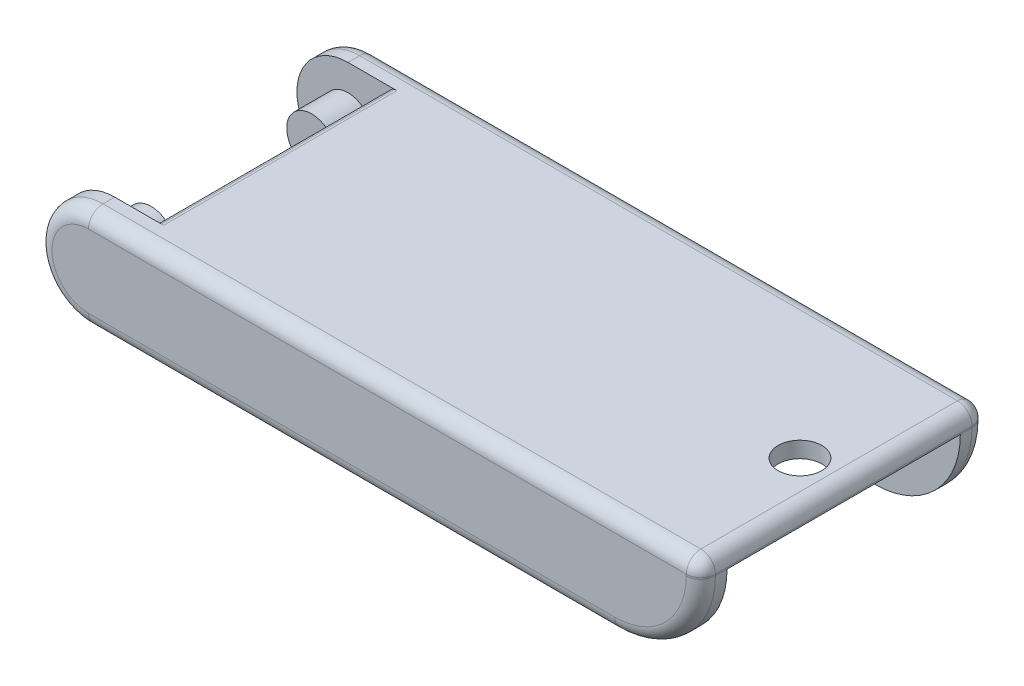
SolidWorks part; units mm, degrees
ref_plane "Plan de face" through (0, 0, 0) normal (0, 0, 1) x (1, 0, 0)
ref_plane "Plan de dessus" through (0, 0, 0) normal (0, 1, 0) x (1, 0, 0)
ref_plane "Plan de droite" through (0, 0, 0) normal (1, 0, 0) x (0, 0, -1)
sketch "Esquisse1" plane through (0, 0, 0) normal (0, 0, 1) x (1, 0, 0)
  line L0 (-26.893, 0) -> (0.9816, 0) construction
  line L1 (0, 23.3763) -> (0, -28.3411) construction
  line L2 (0, -3.5) -> (21.1985, -3.5) construction
  line L3 (0, 3.5) -> (21.7012, 3.5) construction
  line L4 (2.2491, 2) -> (23.4801, 2) construction
  line L5 (1.2823, -2.5) -> (22.2813, -2.5) construction
  line L6 (3.5, 0) -> (3.5, -9.601) construction
  line L7 (6.5, 1.3432) -> (6.5, -4.1096) construction
  line L8 (15, 1.3432) -> (15, -13.5069) construction
  line L9 (2.5971, 0.8) -> (18.066, 0.8) construction
  line L13 (1.5921, 2.4) -> (22.2813, 2.4) construction
  line L14 (42, 9.1268) -> (42, -17.0221) construction
  line L15 (0, 3.5) -> (42, 3.5)
  line L16 (42, 3.5) -> (42, 2.4)
  line L17 (42, 2.4) -> (2.5475, 2.4)
  circle A0 centre (0, 0) radius 1.7 construction
  circle A1 centre (0, 0) radius 2 construction
  arc A2 (0, 3.5) -> (2.5475, 2.4) centre (0, 0) ccw
  circle A3 centre (0, 0) radius 2 construction
  dimension "D1" = 1.5
  dimension "D3" = 3
  dimension "D6" = 1.2
  dimension "D7" = 1.1
  dimension "D2" = 1
  dimension "D4" = 8.5
  dimension "D5" = 3.3
  dimension "D8" = 27
extrude "Boss.-Extru.1" add sketch "Esquisse1" along normal mid plane 19.6
sketch "Esquisse2" plane through (0, 0, 0) normal (0, 0, 1) x (1, 0, 0)
  line L0 (3.5, 0) -> (3.5, -11.6354) construction
  line L1 (18.1041, 6.0822) -> (18.1041, -11.6354) construction
  arc A0 (0, 3.5) -> (2.5475, 2.4) centre (0, 0) ccw construction
  circle A1 centre (0, 0) radius 4
extrude "Enlèv. mat.-Extru.1" cut sketch "Esquisse2" against normal mid plane 16
fillet "Congé1" radius 3 1 edges at (2.5475, 2.4, 8.9)
sketch "Esquisse3" plane through (0, 2.4, 0) normal (0, -1, 0) x (1, 0, 0)
  line L0 (-0.2746, 8) -> (12.8152, 8) construction
  line L1 (-3.5, 8) -> (3.4851, 8) construction
  line L2 (0.6509, -8) -> (14.3578, -8) construction
  line L3 (3.4851, -8) -> (-3.5, -8) construction
  line L5 (10.9642, 8) -> (0.9594, 8)
  line L6 (10.9642, 8) -> (10.9642, -8)
  line L7 (10.9642, -8) -> (0.9594, -8)
  line L8 (0.9594, 8) -> (0.9594, -8)
extrude "Enlèv. mat.-Extru.2" cut sketch "Esquisse3" along normal blind 16
sketch "Esquisse4" plane through (0, 0, 9.8) normal (0, 0, 1) x (1, 0, 0)
  circle A0 centre (0, 0) radius 1.7
extrude "Boss.-Extru.2" add sketch "Esquisse4" against normal up to surface (19.6 mm away)
sketch "Esquisse5" plane through (0, 0, 0) normal (0, 0, 1) x (1, 0, 0)
  circle A0 centre (0, 0) radius 2.2203
extrude "Enlèv. mat.-Extru.3" cut sketch "Esquisse5" against normal mid plane 11
fillet "Congé2" radius 3 1 edges at (3.2, 2.4, 0)
fillet "Congé3" radius 1 1 edges at (1.9365, 3.5, 0)
fillet "Congé4" radius 0.4 1 edges at (2.5453, 3.0857, 0)
sketch "Esquisse6" plane through (0, 2.4, 0) normal (0, -1, 0) x (1, 0, 0)
  line L0 (0, 10.754) -> (0, -11.6354) construction
  line L1 (-1.2002, 8) -> (49.0879, 8) construction
  line L2 (-1.7, 8) -> (1.7, 8) construction
  line L3 (0.7391, -8) -> (44.5924, -8) construction
  line L4 (3.4851, -8) -> (-3.5, -8) construction
  line L5 (42, -10.754) -> (42, 12.3406) construction
  line L6 (-1.6409, 9.8) -> (43.4905, 9.8) construction
  line L7 (3.4851, 9.8) -> (-3.5, 9.8) construction
  line L8 (-1.6409, -9.8) -> (46.179, -9.8) construction
  line L9 (-3.5, -9.8) -> (3.4851, -9.8) construction
  line L11 (0, 9.8) -> (42, 9.8)
  line L12 (0, 9.8) -> (0, 8)
  line L13 (0, 8) -> (42, 8)
  line L14 (42, 9.8) -> (42, 8)
  line L15 (0, -9.8) -> (42, -9.8)
  line L16 (0, -9.8) -> (0, -8)
  line L17 (0, -8) -> (42, -8)
  line L18 (42, -9.8) -> (42, -8)
extrude "Boss.-Extru.3" add sketch "Esquisse6" along normal blind 5.9
sketch "Esquisse7" plane through (0, 0, 0) normal (0, 1, 0) x (1, 0, 0)
  line L0 (0, 5.5533) -> (0, -14.7647) construction
  line L1 (13, 13.134) -> (13, -11.2388) construction
  line L2 (-0.8035, 0) -> (45.7383, 0) construction
  line L3 (4.4542, 8) -> (42, 8) construction
  line L4 (13, 8.5) -> (13, 7.5)
  line L5 (13, -8.5) -> (13, -7.5)
  arc A0 (13, 8.5) -> (13, 7.5) centre (13, 8) ccw
  arc A1 (13, -8.5) -> (13, -7.5) centre (13, -8) cw
  dimension "D1" = 13
revolve "Révolution1" add sketch "Esquisse7" angle 360 about L1
fillet "Congé5" radius 5.9 2 edges at (42, -3.5, 8.9) (42, -3.5, -8.9)
sketch "Esquisse8" plane through (0, 2.4, 0) normal (0, -1, 0) x (1, 0, 0)
  line L0 (-0.7594, 0) -> (45.8264, 0) construction
  line L1 (0, 5.5092) -> (0, -10.5336) construction
  circle A0 centre (39, 0) radius 1.5
  dimension "D1" = 39
extrude "Enlèv. mat.-Extru.4" cut sketch "Esquisse8" against normal blind 7
fillet "Congé6" radius 1 10 edges at (21, 3.5, -9.8) (-3.5, 0, -9.8) (18.05, -3.5, -9.8) (40.2719, -1.7719, -9.8) (42, 2.95, -9.8) (-3.5, 0, 9.8) (21, 3.5, 9.8) (42, 2.95, 9.8) (40.2719, -1.7719, 9.8) (18.05, -3.5, 9.8)
fillet "Congé7" radius 1 3 edges at (41.7071, 3.2071, 9.5071) (41.7071, 3.2071, -9.5071) (42, 3.5, 0)
sketch "Esquisse10" plane through (0, 2.4, 0) normal (0, -1, 0) x (1, 0, 0)
  text T0 "www.a4.fr" font "Arial Narrow" height 7
extrude "Enlèv. mat.-Extru.6" cut sketch "Esquisse10" against normal blind 0.5
sketch "Esquisse11" plane through (0, 2.4, 0) normal (0, -1, 0) x (1, 0, 0)
  line L1 (15.0189, 7.0959) -> (19.9111, 7.0959)
  line L2 (15.0189, 7.0959) -> (15.0189, 3.3055)
  line L3 (15.0189, 3.3055) -> (19.9111, 3.3055)
  line L4 (19.9111, 7.0959) -> (19.9111, 3.3055)
extrude "Boss.-Extru.4" add sketch "Esquisse11" against normal blind 1
